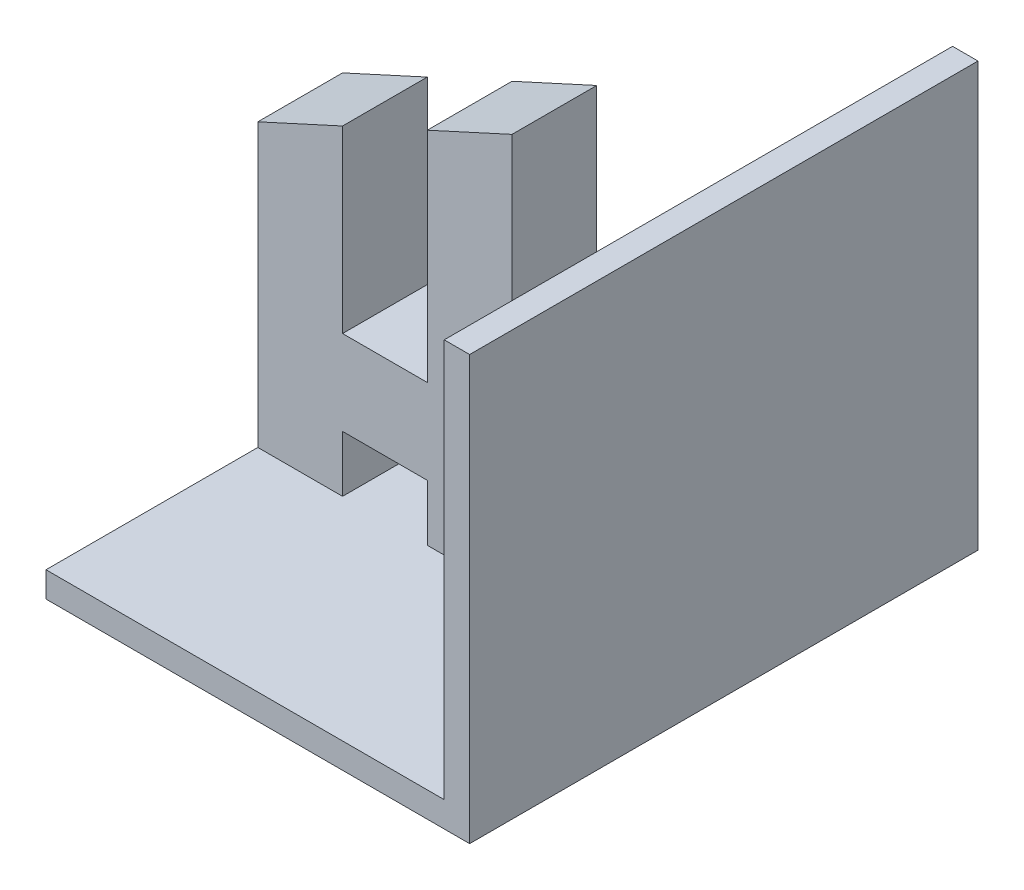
SolidWorks part; units mm, degrees
ref_plane "Front Plane" through (0, 0, 0) normal (0, 0, 1) x (1, 0, 0)
ref_plane "Top Plane" through (0, 0, 0) normal (0, 1, 0) x (1, 0, 0)
ref_plane "Right Plane" through (0, 0, 0) normal (1, 0, 0) x (0, 0, -1)
sketch "Sketch1" plane through (0, 0, 0) normal (0, 0, 1) x (1, 0, 0)
  line L0 (0, 0) -> (-100, 0)
  line L1 (0, 0) -> (0, 50)
  dimension "D1" = 50
  dimension "D2" = 100
extrude "Extrude-Thin1" add sketch "Sketch1" along normal mid plane 60 thin
sketch "Sketch3" plane through (0, 3, 0) normal (0, 1, 0) x (-1, 0, 0)
  line L0 (100, 0) -> (3, 0) construction
  line L1 (100, 30) -> (100, -30) construction
  line L2 (3, 30) -> (3, -30) construction
  line L3 (90, -5) -> (90, 5)
  line L4 (90, 5) -> (80, 5)
  line L5 (80, 5) -> (80, -5)
  line L6 (70, -5) -> (70, 5)
  line L7 (70, 5) -> (60, 5)
  line L8 (60, 5) -> (60, -5)
  line L9 (50, -5) -> (50, 5)
  line L10 (50, 5) -> (40, 5)
  line L11 (40, 5) -> (40, -5)
  line L12 (30, -5) -> (30, 5)
  line L13 (30, 5) -> (20, 5)
  line L14 (20, 5) -> (20, -5)
  line L15 (30, -5) -> (20, -5)
  line L16 (50, -5) -> (40, -5)
  line L17 (70, -5) -> (60, -5)
  line L18 (90, -5) -> (80, -5)
  point P23 (20, 0)
  point P24 (30, 0)
  point P25 (40, 0)
  point P26 (50, 0)
  point P27 (60, 0)
  point P28 (70, 0)
  point P29 (80, 0)
  point P30 (90, 0)
  dimension "D1" = 10
  dimension "D2" = 5
  dimension "D3" = 10
  dimension "D4" = 20
extrude "Extrude1" add sketch "Sketch3" along normal through all
sketch "Sketch4" plane through (0, 0, 5) normal (0, 0, 1) x (1, 0, 0)
  line L0 (-90, 50) -> (-20, 50)
  line L1 (-20, 50) -> (-20, 3) construction
  line L2 (-30, 50) -> (-20, 50) construction
  line L3 (-20, 50) -> (-90, 18)
  line L4 (-90, 50) -> (-90, 3) construction
  line L5 (-90, 18) -> (-90, 50)
  line L6 (-100, 3) -> (-3, 3) construction
  dimension "D1" = 15
extrude "Cut-Extrude1" cut sketch "Sketch4" against normal up to next
sketch "Sketch6" plane through (0, 0, 30) normal (0, 0, 1) x (1, 0, 0)
  line L1 (-100, 0) -> (-50, 0)
  line L2 (-100, 0) -> (-100, 36.2857)
  line L3 (-100, 36.2857) -> (-50, 36.2857)
  line L4 (-50, 0) -> (-50, 36.2857)
extrude "Cut-Extrude2" cut sketch "Sketch6" against normal through all
sketch "Sketch5" plane through (-3, 0, 0) normal (-1, 0, 0) x (0, 0, 1)
  line L1 (-5, 19.6429) -> (5, 19.6429)
  line L2 (-5, 19.6429) -> (-5, 9.6429)
  line L3 (-5, 9.6429) -> (5, 9.6429)
  line L4 (5, 19.6429) -> (5, 9.6429)
  line L6 (-5, 36.2857) -> (-5, 3) construction
  line L7 (5, 36.2857) -> (5, 3) construction
  dimension "D1" = 10
extrude "Extrude2" add sketch "Sketch5" along normal up to vertex (37 mm away)
